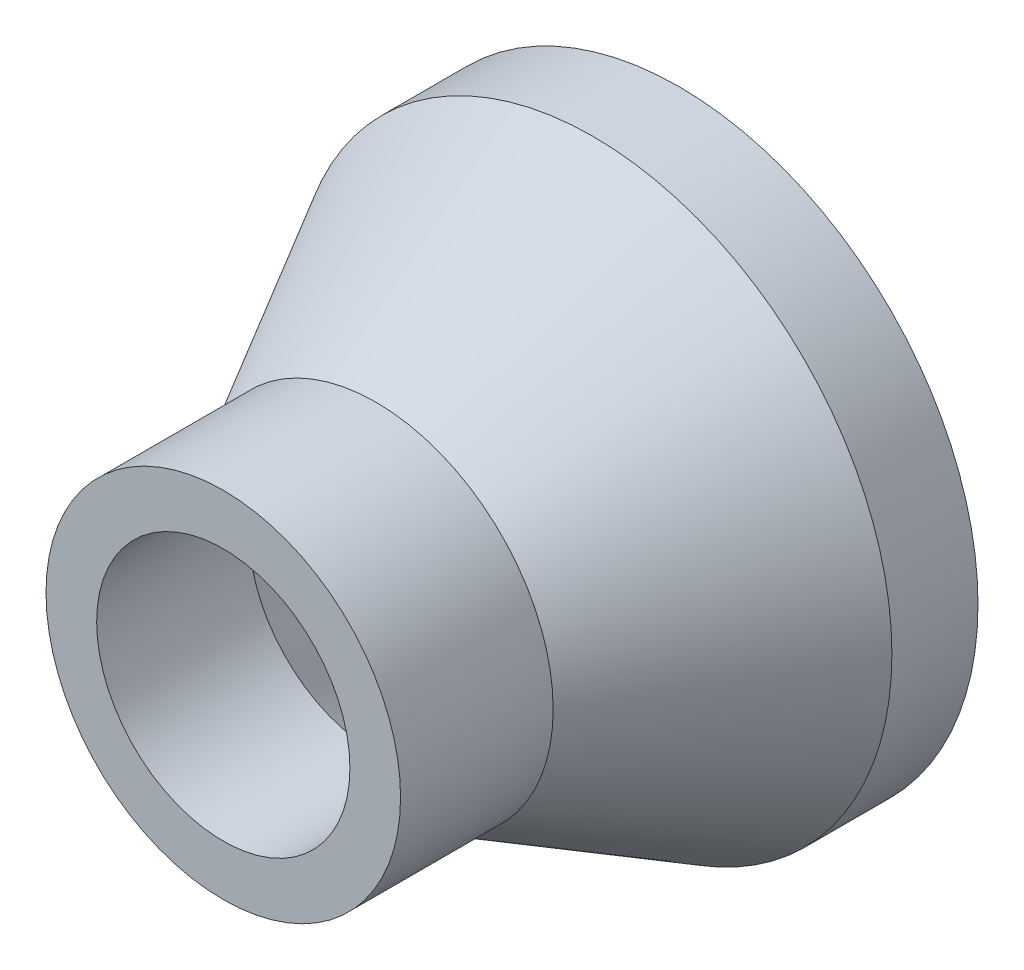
SolidWorks part; units mm, degrees
ref_plane "Plan de face" through (0, 0, 0) normal (0, 0, 1) x (1, 0, 0)
ref_plane "Plan de dessus" through (0, 0, 0) normal (0, 1, 0) x (1, 0, 0)
ref_plane "Plan de droite" through (0, 0, 0) normal (1, 0, 0) x (0, 0, -1)
sketch "Esquisse1" plane through (0, 0, 0) normal (1, 0, 0) x (0, 0, -1)
  line L0 (14.9634, 0) -> (-31.3518, 0) construction
  line L1 (0, -16.2697) -> (0, 38.8335) construction
  line L2 (14.9634, 5.9) -> (-31.3518, 5.9) construction
  line L3 (-9, -16.2697) -> (-9, 11.2819) construction
  line L4 (-11.8667, 3.5) -> (-5.9875, 3.5) construction
  line L5 (-10.0957, 2.5) -> (-5.9875, 2.5) construction
  line L6 (-6, 6.8166) -> (-6, -0.5578) construction
  line L7 (-1.7, 7.9779) -> (-1.7, 4.0096) construction
  line L8 (2.7659, 4.9) -> (-2.2713, 4.9) construction
  line L9 (-9, 2.5) -> (-9, 3.5)
  line L10 (-9, 3.5) -> (-5.9875, 3.5)
  line L11 (-5.9875, 3.5) -> (-1.7, 5.9)
  line L12 (-1.7, 5.9) -> (0, 5.9)
  line L13 (0, 5.9) -> (0, 4.9)
  line L14 (0, 4.9) -> (-1.7, 4.9)
  line L15 (-1.7, 4.9) -> (-5.9875, 2.5)
  line L16 (-5.9875, 2.5) -> (-9, 2.5)
  dimension "D1" = 5.9
  dimension "D2" = 9
  dimension "D3" = 2.5
  dimension "D4" = 3.5
  dimension "D5" = 3
  dimension "D6" = 1.7
  dimension "D7" = 1
revolve "Révolution1" add sketch "Esquisse1" angle 360 about L0
